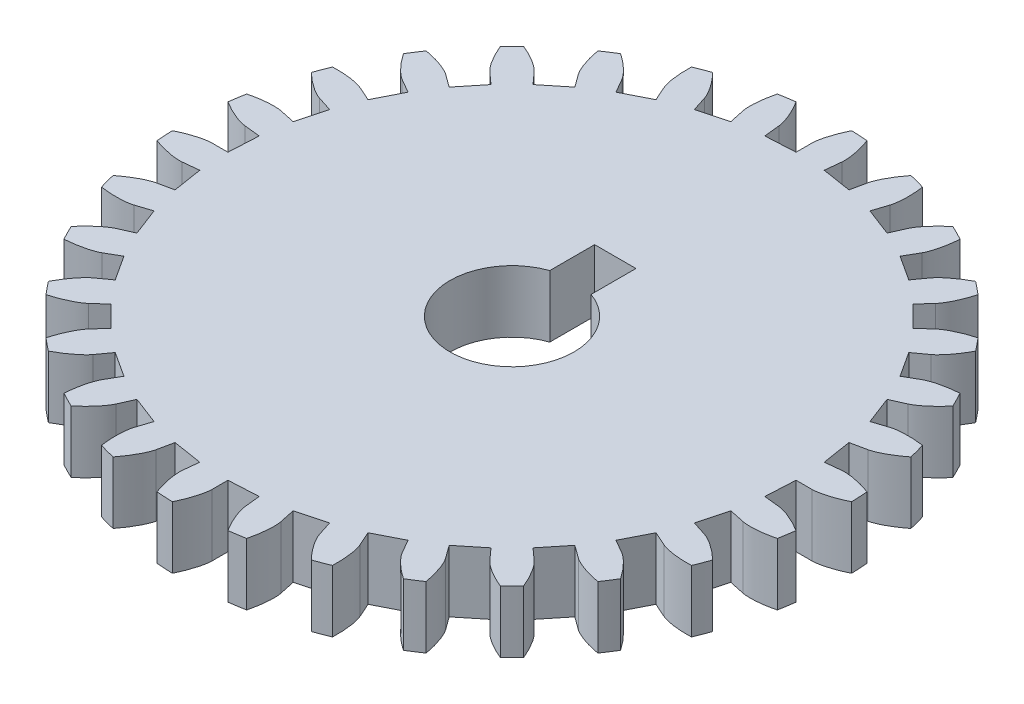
SolidWorks part; units mm, degrees
ref_plane "Front Plane" through (0, 0, 0) normal (0, 0, 1) x (1, 0, 0)
ref_plane "Top Plane" through (0, 0, 0) normal (0, 1, 0) x (1, 0, 0)
ref_plane "Right Plane" through (0, 0, 0) normal (1, 0, 0) x (0, 0, -1)
sketch "Sketch1" plane through (0, 0, 0) normal (0, 1, 0) x (1, 0, 0)
  line L0 (0, 0) -> (0, 7.2611) construction
  line L1 (0, 0) -> (-7.2611, 0) construction
  line L2 (0, 0) -> (-7.989, -0.4187) construction
  line L3 (0, 0) -> (-7.2213, -0.759) construction
  line L4 (0, 0) -> (-7.1024, -1.5097) construction
  circle A0 centre (0, 0) radius 7.5 construction
  circle A1 centre (0, 0) radius 7.2611 construction
  circle A2 centre (0, 0) radius 6.875 construction
  circle A3 centre (0, 0) radius 8 construction
  spline S0 degree 4 poles (-7.2611, 0) (-7.273, 0) (-7.3065, -0.0012) (-7.3694, -0.0084) (-7.4711, -0.0269) (-7.5988, -0.0604) (-7.7608, -0.1148) (-7.9468, -0.1931) (-8.1453, -0.2935) (-8.3537, -0.4178) (-8.5543, -0.5547) (-8.7468, -0.7026) (-8.9314, -0.8603) (-9.1459, -1.0623) (-9.3898, -1.3207) (-9.6542, -1.6423) (-9.9283, -2.0326) (-10.1781, -2.4492) (-10.3991, -2.8819) (-10.5922, -3.3274) (-10.7579, -3.7842) (-10.8969, -4.249) (-10.9959, -4.6632) (-11.0649, -5.0192) (-11.1121, -5.3214) (-11.1436, -5.5573) (-11.1696, -5.8078) (-11.1887, -6.0323) (-11.2062, -6.3558) (-11.2123, -6.5935) (-11.2143, -6.9584) (-11.2057, -7.0886) (-11.2024, -7.2214) knots 0 0 0 0 0 0.005377 0.015084 0.028532 0.04661 0.064855 0.092111 0.119476 0.146842 0.174209 0.201575 0.228941 0.256307 0.307035 0.361767 0.4165 0.471232 0.525964 0.580697 0.635429 0.690161 0.744894 0.77226 0.799626 0.826992 0.854358 0.881725 0.909091 0.954545 1 1 1 1 1 construction
  spline S1 degree 4 poles (-7.2611, 0) (-7.273, 0) (-7.3065, -0.0012) (-7.3694, -0.0084) (-7.4711, -0.0269) (-7.5988, -0.0604) (-7.7608, -0.1148) (-7.9468, -0.1931) (-8.1453, -0.2935) (-8.3537, -0.4178) (-8.5543, -0.5547) (-8.7468, -0.7026) (-8.9314, -0.8603) (-9.1459, -1.0623) (-9.3898, -1.3207) (-9.6542, -1.6423) (-9.9283, -2.0326) (-10.1781, -2.4492) (-10.3991, -2.8819) (-10.5922, -3.3274) (-10.7579, -3.7842) (-10.8969, -4.249) (-10.9959, -4.6632) (-11.0649, -5.0192) (-11.1121, -5.3214) (-11.1436, -5.5573) (-11.1696, -5.8078) (-11.1887, -6.0323) (-11.1999, -6.2405) (-11.2046, -6.3523) (-11.2064, -6.4074) knots 0 0 0 0 0 0.005377 0.015084 0.028532 0.04661 0.064855 0.092111 0.119476 0.146842 0.174209 0.201575 0.228941 0.256307 0.307035 0.361767 0.4165 0.471232 0.525964 0.580697 0.635429 0.690161 0.744894 0.77226 0.799626 0.826992 0.854358 0.881725 0.909091 0.909091 0.909091 0.909091 0.909091
  dimension "D1" = 16
  dimension "D2" = 15
  dimension "D3" = 14.5222
  dimension "D4" = 13.75
  dimension "D5" = 7.2611
  dimension "D6" = 3
  dimension "D7" = 6
  dimension "D8" = 12
sketch "Sketch2" plane through (0, 0, 0) normal (0, 1, 0) x (1, 0, 0)
  line L0 (0, 0) -> (-7.989, -0.4187) construction
  line L1 (0, 0) -> (-7.989, -0.4187) construction
  line L2 (0, 0) -> (-7.2213, -0.759) construction
  line L3 (0, 0) -> (-7.2611, 0) construction
  line L4 (0, 0) -> (-7.1024, -1.5097) construction
  line L5 (0, 0) -> (-7.2213, -0.759) construction
  line L6 (0, 0) -> (-7.2611, 0) construction
  line L7 (0, 0) -> (-7.1024, -1.5097) construction
  line L8 (-7.2213, -0.759) -> (-6.8373, -0.7186)
  line L9 (-6.8373, -0.7186) -> (-6.7248, -1.4294)
  line L10 (-6.7248, -1.4294) -> (-7.1024, -1.5097) construction
  line L11 (-6.7248, -1.4294) -> (-1.4672, -0.3119)
  line L12 (-7.2611, 0) -> (-1.5, 0)
  circle A0 centre (0, 0) radius 6.875 construction
  circle A1 centre (0, 0) radius 7.2611 construction
  circle A2 centre (0, 0) radius 7.5 construction
  circle A3 centre (0, 0) radius 8 construction
  circle A4 centre (0, 0) radius 6.875 construction
  circle A5 centre (0, 0) radius 7.2611 construction
  circle A6 centre (0, 0) radius 7.5 construction
  circle A7 centre (0, 0) radius 8 construction
  arc A8 (-7.9762, -0.6166) -> (-7.997, -0.2206) centre (0, 0) cw
  circle A11 centre (0, 0) radius 1.5 construction
  arc A12 (-1.5, 0) -> (-1.4672, -0.3119) centre (0, 0) ccw
  spline S0 degree 4 poles (-37.1887, -999.5044) (-5.2901, -21.0251) (-5.6721, -0.4462) (-6.6105, 0.1296) (-7.4711, -0.0269) (-7.5988, -0.0604) (-7.7608, -0.1148) (-7.9468, -0.1931) (-8.1453, -0.2935) (-8.3537, -0.4178) (-8.5543, -0.5547) (-8.7468, -0.7026) (-8.9314, -0.8603) (-9.1459, -1.0623) (-9.3898, -1.3207) (-9.6542, -1.6423) (-9.9283, -2.0326) (-10.1781, -2.4492) (-10.3991, -2.8819) (-10.5922, -3.3274) (-10.7579, -3.7842) (-10.8969, -4.249) (-10.9959, -4.6632) (-11.0649, -5.0192) (-11.1121, -5.3214) (-11.1436, -5.5573) (-11.1696, -5.8078) (-11.2681, -6.9656) (-11.2301, -9.7736) (-9.8958, 22.1895) (-43.7182, -1005.8588) knots -0.347705 -0.347705 -0.347705 -0.347705 -0.347705 0.005377 0.015084 0.028532 0.04661 0.064855 0.092111 0.119476 0.146842 0.174209 0.201575 0.228941 0.256307 0.307035 0.361767 0.4165 0.471232 0.525964 0.580697 0.635429 0.690161 0.744894 0.77226 0.799626 0.826992 0.854358 0.881725 1.364249 1.364249 1.364249 1.364249 1.364249 only from (-7.2611, 0) to (-11.2064, -6.4074) construction
  spline S1 degree 4 poles (-7.2611, 0) (-7.273, 0) (-7.3065, -0.0012) (-7.3694, -0.0084) (-7.4711, -0.0269) (-7.5988, -0.0604) (-7.7505, -0.1114) (-7.8707, -0.1612) (-7.9524, -0.1989) (-7.997, -0.2206) knots 0 0 0 0 0 0.005377 0.015084 0.028532 0.04661 0.064855 0.087193 0.087193 0.087193 0.087193 0.087193
  spline S2 degree 4 poles (-7.2213, -0.759) (-7.2332, -0.7602) (-7.2666, -0.7625) (-7.3299, -0.762) (-7.433, -0.7542) (-7.5635, -0.7343) (-7.7196, -0.6994) (-7.8445, -0.6624) (-7.9297, -0.6335) (-7.9762, -0.6166) knots 0 0 0 0 0 0.005377 0.015084 0.028532 0.04661 0.064855 0.087193 0.087193 0.087193 0.087193 0.087193
  point P21 (-6.8373, -0.7186)
  point P24 (-6.7248, -1.4294)
  dimension "D2" = 3
extrude "Boss-Extrude1" add sketch "Sketch2" along normal blind 1.5
pattern_circular "CirPattern1" count 30 over 360 of "Boss-Extrude1"
sketch "Sketch3" plane through (0, 1.5, 0) normal (0, 1, 0) x (1, 0, 0)
  line L1 (0.5, 0.5) -> (-0.5, 0.5)
  line L2 (0.5, 0.5) -> (0.5, 2.5)
  line L3 (0.5, 2.5) -> (-0.5, 2.5)
  line L4 (-0.5, 0.5) -> (-0.5, 2.5)
  line L5 (0.5, 0.5) -> (-0.5, 2.5) construction
  line L6 (0.5, 2.5) -> (-0.5, 0.5) construction
  circle A0 centre (0, 0) radius 1.5 construction
  point P0 (0, 1.5)
  dimension "D1" = 2
  dimension "D2" = 1
extrude "Cut-Extrude1" cut sketch "Sketch3" against normal up to surface (1.5 mm away)
equation "\"Module\"= .5"
equation "\"Number of Teeth\" = 30"
equation "\"Pressure Angle\"= 14.5deg"
equation "\"Pitch Diameter\"= \"Number of Teeth\" * \"Module\""
equation "\"Circular Pitch\"= pi * \"Module\""
equation "\"Addendum\"= \"Module\""
equation "\"Dedendum\"= 1.25 * \"Module\""
equation "\"Base Diameter\"= \"Pitch Diameter\" * cos ( \"Pressure Angle\" )"
equation "\"Base Radius\"= \"Base Diameter\" / 2"
equation "\"Width\"= 1.5"
equation "\"Outside Diameter\"= \"Pitch Diameter\" + 2 * \"Addendum\""
equation "\"D1@Sketch1\"=\"Outside Diameter\""
equation "\"D3@Sketch1\"=\"Base Diameter\""
equation "\"Root Diameter\"= \"Pitch Diameter\" - 2 * \"Dedendum\""
equation "\"D4@Sketch1\"=\"Root Diameter\""
equation "\"Tooth Angle\"= 360 / \"Number of Teeth\""
equation "\"D6@Sketch1\"=\"Tooth Angle\"/4"
equation "\"D7@Sketch1\"=\"Tooth Angle\"/2"
equation "\"D8@Sketch1\"=\"Tooth Angle\""
equation "\"D2@Sketch1\" = \"Pitch Diameter\""
equation "\"Shaft Diameter\"= 3"
equation "\"D1@CirPattern1\" = \"Number of Teeth\""
equation "\"D2@Sketch2\"= \"Shaft Diameter\""
equation "\"D1@Boss-Extrude1\" = \"Width\""
